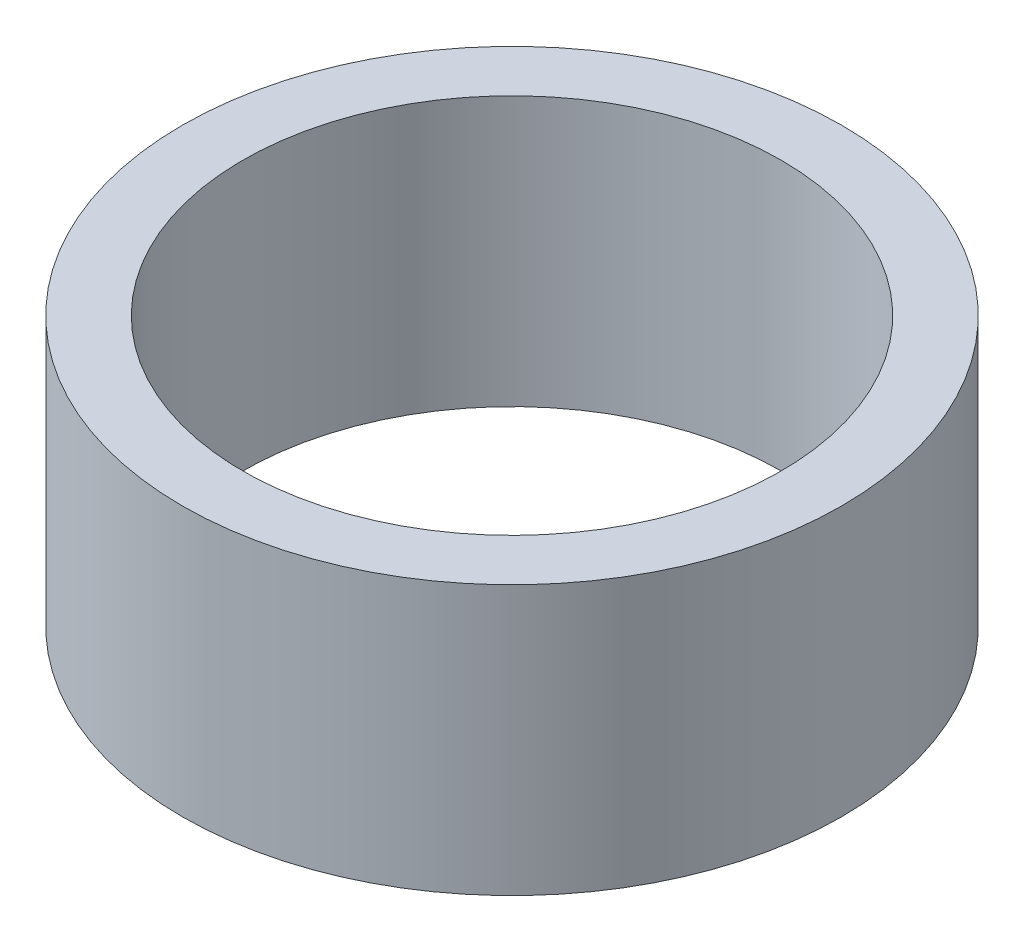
SolidWorks part; units mm, degrees
ref_plane "Front Plane" through (0, 0, 0) normal (0, 0, 1) x (1, 0, 0)
ref_plane "Top Plane" through (0, 0, 0) normal (0, 1, 0) x (1, 0, 0)
ref_plane "Right Plane" through (0, 0, 0) normal (1, 0, 0) x (0, 0, -1)
sketch "Sketch3" plane through (0, 0, 0) normal (0, 1, 0) x (1, 0, 0)
  circle A1 centre (0, 0) radius 34.6075
  circle A2 centre (0, 0) radius 28.2575
  dimension "D1" = 56.515
  dimension "D2" = 69.215
extrude "Boss-Extrude1" add sketch "Sketch3" along normal blind 28.2575
